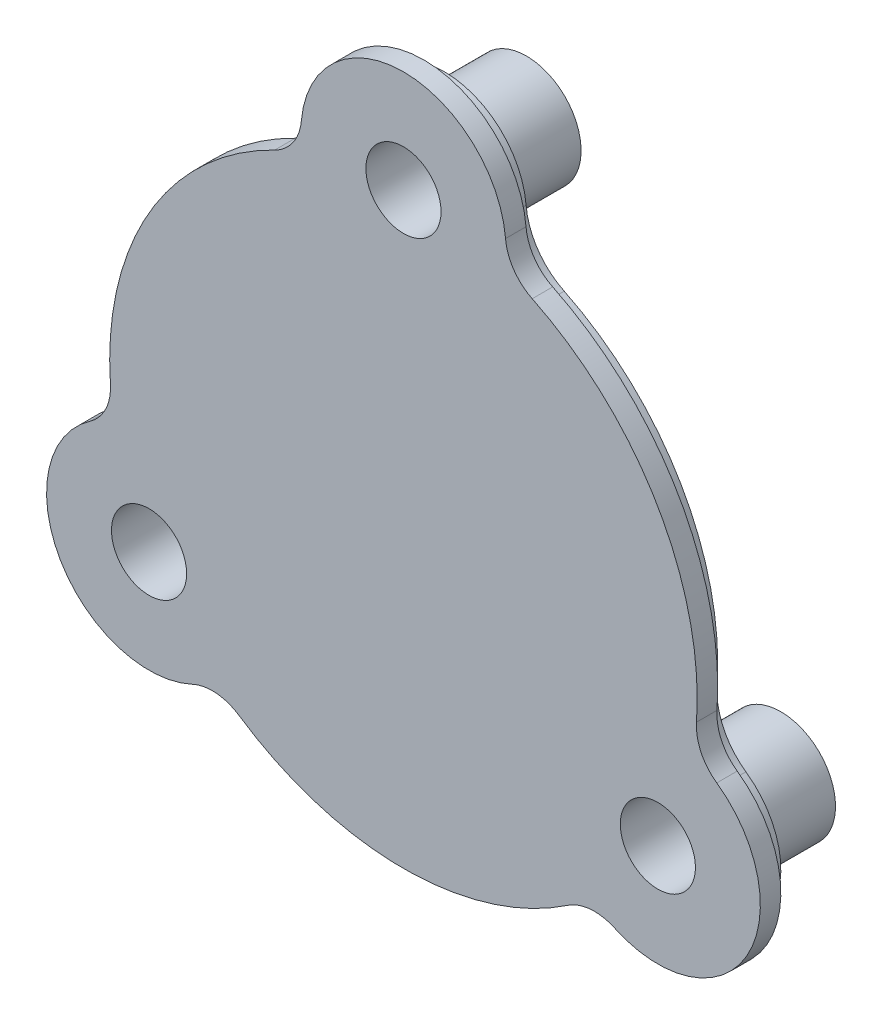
SolidWorks part; units mm, degrees
ref_plane "Front Plane" through (0, 0, 0) normal (0, 0, 1) x (1, 0, 0)
ref_plane "Top Plane" through (0, 0, 0) normal (0, 1, 0) x (1, 0, 0)
ref_plane "Right Plane" through (0, 0, 0) normal (1, 0, 0) x (0, 0, -1)
sketch "Sketch1" plane through (0, 0, 0) normal (0, 0, 1) x (1, 0, 0)
  line L0 (0, 0) -> (-37.2391, -21.5) construction
  line L1 (0, 0) -> (0, 43) construction
  line L2 (0, 0) -> (37.2391, -21.5) construction
  arc A0 (42.895, -3.0038) -> (18.8462, 38.65) centre (0, 0) ccw
  arc A1 (14.9415, 44.324) -> (-14.9415, 44.324) centre (0, 43) ccw
  arc A2 (30.915, -35.1017) -> (45.8564, -9.2223) centre (37.2391, -21.5) ccw
  arc A3 (-45.8564, -9.2223) -> (-30.915, -35.1017) centre (-37.2391, -21.5) ccw
  arc A4 (-18.8462, 38.65) -> (-42.895, -3.0038) centre (0, 0) ccw
  arc A5 (-24.0488, -35.6462) -> (24.0488, -35.6462) centre (0, 0) ccw
  arc A6 (-18.8462, 38.65) -> (-14.9415, 44.324) centre (-21.9141, 44.9419) ccw
  arc A7 (-45.8564, -9.2223) -> (-42.895, -3.0038) centre (-49.8779, -3.4927) ccw
  arc A8 (-30.915, -35.1017) -> (-24.0488, -35.6462) centre (-27.9637, -41.4491) cw
  arc A9 (24.0488, -35.6462) -> (30.915, -35.1017) centre (27.9637, -41.4491) cw
  arc A10 (45.8564, -9.2223) -> (42.895, -3.0038) centre (49.8779, -3.4927) cw
  arc A11 (18.8462, 38.65) -> (14.9415, 44.324) centre (21.9141, 44.9419) cw
  point P11 (0, 0)
  point P12 (0, 0)
  point P13 (0, 0)
  point P14 (0, 0)
  point P15 (0, 0)
  point P18 (-14.7701, 40.3837)
  point P23 (-27.5883, -32.9831)
  point P30 (0, 0)
  point P31 (-0.0524, 16.3372)
  dimension "D1" = 43
  dimension "D2" = 30
  dimension "D5" = 30
  dimension "D6" = 30
  dimension "D7" = 7
  dimension "D3" = 120
  dimension "D4" = 120
  dimension "D8" = 43
extrude "Boss-Extrude1" add sketch "Sketch1" against normal blind 3
sketch "Sketch2" plane through (0, 0, -3) normal (0, 0, -1) x (-1, 0, 0)
  arc A0 (11.9532, 44.0592) -> (17.5313, 35.9535) centre (21.9141, 44.9419) ccw
  arc A1 (39.9023, -2.7942) -> (17.5313, 35.9535) centre (0, 0) ccw
  arc A2 (39.9023, -2.7942) -> (44.133, -11.6779) centre (49.8779, -3.4927) ccw
  arc A3 (32.1798, -32.3813) -> (44.133, -11.6779) centre (37.2391, -21.5) ccw
  arc A4 (32.1798, -32.3813) -> (22.371, -33.1593) centre (27.9637, -41.4491) ccw
  arc A5 (-22.371, -33.1593) -> (22.371, -33.1593) centre (0, 0) ccw
  arc A6 (-22.371, -33.1593) -> (-32.1798, -32.3813) centre (-27.9637, -41.4491) ccw
  arc A7 (-44.133, -11.6779) -> (-32.1798, -32.3813) centre (-37.2391, -21.5) ccw
  arc A8 (-44.133, -11.6779) -> (-39.9023, -2.7942) centre (-49.8779, -3.4927) ccw
  arc A9 (-17.5313, 35.9535) -> (-39.9023, -2.7942) centre (0, 0) ccw
  arc A10 (-17.5313, 35.9535) -> (-11.9532, 44.0592) centre (-21.9141, 44.9419) ccw
  arc A11 (11.9532, 44.0592) -> (-11.9532, 44.0592) centre (0, 43) ccw
  arc A12 (14.9415, 44.324) -> (18.8462, 38.65) centre (21.9141, 44.9419) ccw
  arc A13 (14.9415, 44.324) -> (-14.9415, 44.324) centre (0, 43) ccw
  arc A14 (-18.8462, 38.65) -> (-14.9415, 44.324) centre (-21.9141, 44.9419) ccw
  arc A15 (-18.8462, 38.65) -> (-42.895, -3.0038) centre (0, 0) ccw
  arc A16 (-45.8564, -9.2223) -> (-42.895, -3.0038) centre (-49.8779, -3.4927) ccw
  arc A17 (-45.8564, -9.2223) -> (-30.915, -35.1017) centre (-37.2391, -21.5) ccw
  arc A18 (-24.0488, -35.6462) -> (-30.915, -35.1017) centre (-27.9637, -41.4491) ccw
  arc A19 (-24.0488, -35.6462) -> (24.0488, -35.6462) centre (0, 0) ccw
  arc A20 (30.915, -35.1017) -> (24.0488, -35.6462) centre (27.9637, -41.4491) ccw
  arc A21 (30.915, -35.1017) -> (45.8564, -9.2223) centre (37.2391, -21.5) ccw
  arc A22 (42.895, -3.0038) -> (45.8564, -9.2223) centre (49.8779, -3.4927) ccw
  arc A23 (42.895, -3.0038) -> (18.8462, 38.65) centre (0, 0) ccw
  arc A24 (14.9415, 44.324) -> (18.8462, 38.65) centre (21.9141, 44.9419) ccw
  arc A25 (14.9415, 44.324) -> (-14.9415, 44.324) centre (0, 43) ccw
  arc A26 (-18.8462, 38.65) -> (-14.9415, 44.324) centre (-21.9141, 44.9419) ccw
  arc A27 (-18.8462, 38.65) -> (-42.895, -3.0038) centre (0, 0) ccw
  arc A28 (-45.8564, -9.2223) -> (-42.895, -3.0038) centre (-49.8779, -3.4927) ccw
  arc A29 (-45.8564, -9.2223) -> (-30.915, -35.1017) centre (-37.2391, -21.5) ccw
  arc A30 (-24.0488, -35.6462) -> (-30.915, -35.1017) centre (-27.9637, -41.4491) ccw
  arc A31 (-24.0488, -35.6462) -> (24.0488, -35.6462) centre (0, 0) ccw
  arc A32 (30.915, -35.1017) -> (24.0488, -35.6462) centre (27.9637, -41.4491) ccw
  arc A33 (30.915, -35.1017) -> (45.8564, -9.2223) centre (37.2391, -21.5) ccw
  arc A34 (42.895, -3.0038) -> (45.8564, -9.2223) centre (49.8779, -3.4927) ccw
  arc A35 (42.895, -3.0038) -> (18.8462, 38.65) centre (0, 0) ccw
extrude "Boss-Extrude2" add sketch "Sketch2" along normal blind 3 contours A0 A1 A2 A3 A4 A5 A6 A7 A8 A9 A10 A11
sketch "Sketch3" plane through (0, 0, -6) normal (0, 0, -1) x (-1, 0, 0)
  circle A0 centre (0, 43) radius 8
  circle A1 centre (37.2391, -21.5) radius 8
  circle A2 centre (-37.2391, -21.5) radius 8
  circle A3 centre (0, 43) radius 3
  circle A4 centre (37.2391, -21.5) radius 3
  circle A5 centre (-37.2391, -21.5) radius 3
  arc A12 (11.9532, 44.0592) -> (-11.9532, 44.0592) centre (0, 43) ccw
  arc A13 (-17.5313, 35.9535) -> (-11.9532, 44.0592) centre (-21.9141, 44.9419) ccw
  arc A14 (-17.5313, 35.9535) -> (-39.9023, -2.7942) centre (0, 0) ccw
  arc A15 (-44.133, -11.6779) -> (-39.9023, -2.7942) centre (-49.8779, -3.4927) ccw
  arc A16 (-44.133, -11.6779) -> (-32.1798, -32.3813) centre (-37.2391, -21.5) ccw
  arc A17 (-22.371, -33.1593) -> (-32.1798, -32.3813) centre (-27.9637, -41.4491) ccw
  arc A18 (-22.371, -33.1593) -> (22.371, -33.1593) centre (0, 0) ccw
  arc A19 (32.1798, -32.3813) -> (22.371, -33.1593) centre (27.9637, -41.4491) ccw
  arc A20 (32.1798, -32.3813) -> (44.133, -11.6779) centre (37.2391, -21.5) ccw
  arc A21 (39.9023, -2.7942) -> (44.133, -11.6779) centre (49.8779, -3.4927) ccw
  arc A22 (39.9023, -2.7942) -> (17.5313, 35.9535) centre (0, 0) ccw
  arc A23 (11.9532, 44.0592) -> (17.5313, 35.9535) centre (21.9141, 44.9419) ccw
  arc A24 (11.9532, 44.0592) -> (-11.9532, 44.0592) centre (0, 43) ccw construction
  arc A25 (-17.5313, 35.9535) -> (-11.9532, 44.0592) centre (-21.9141, 44.9419) ccw construction
  arc A26 (-17.5313, 35.9535) -> (-39.9023, -2.7942) centre (0, 0) ccw construction
  arc A27 (-44.133, -11.6779) -> (-39.9023, -2.7942) centre (-49.8779, -3.4927) ccw construction
  arc A28 (-44.133, -11.6779) -> (-32.1798, -32.3813) centre (-37.2391, -21.5) ccw construction
  arc A29 (-22.371, -33.1593) -> (-32.1798, -32.3813) centre (-27.9637, -41.4491) ccw construction
  arc A30 (-22.371, -33.1593) -> (22.371, -33.1593) centre (0, 0) ccw construction
  arc A31 (32.1798, -32.3813) -> (22.371, -33.1593) centre (27.9637, -41.4491) ccw construction
  arc A32 (32.1798, -32.3813) -> (44.133, -11.6779) centre (37.2391, -21.5) ccw construction
  arc A33 (39.9023, -2.7942) -> (44.133, -11.6779) centre (49.8779, -3.4927) ccw construction
  arc A34 (39.9023, -2.7942) -> (17.5313, 35.9535) centre (0, 0) ccw construction
  arc A35 (11.9532, 44.0592) -> (17.5313, 35.9535) centre (21.9141, 44.9419) ccw construction
  dimension "D2" = 16
  dimension "D3" = 16
  dimension "D4" = 16
  dimension "D5" = 6
  dimension "D6" = 6
  dimension "D7" = 6
  dimension "D1" = 0
extrude "Boss-Extrude3" add sketch "Sketch3" along normal blind 12
sketch "Sketch4" plane through (0, 0, 0) normal (0, 0, 1) x (1, 0, 0)
  circle A0 centre (37.2391, -21.5) radius 8 construction
  circle A1 centre (-37.2391, -21.5) radius 8 construction
  circle A2 centre (0, 43) radius 8 construction
  circle A3 centre (37.2391, -21.5) radius 8 construction
  circle A4 centre (-37.2391, -21.5) radius 8 construction
  circle A5 centre (0, 43) radius 8 construction
  circle A6 centre (0, 43) radius 5.5
  circle A7 centre (37.2391, -21.5) radius 5.5
  circle A8 centre (-37.2391, -21.5) radius 5.5
  dimension "D1" = 11
  dimension "D2" = 11
  dimension "D3" = 11
extrude "Cut-Extrude1" cut sketch "Sketch4" against normal blind 12
equation "\"A\"= 43"
equation "\"B\"= 18"
equation "\"C\"= 3"
equation "\"D1@Boss-Extrude1\"=\"C\""
equation "\"D2@Sketch2\"=\"C\""
equation "\"D1@Boss-Extrude2\"=\"C\""
equation "\"D1@Boss-Extrude3\"=\"B\"-(\"C\"*2)"
equation "\"D1@Cut-Extrude1\"=\"B\"-(\"C\"*2)"
